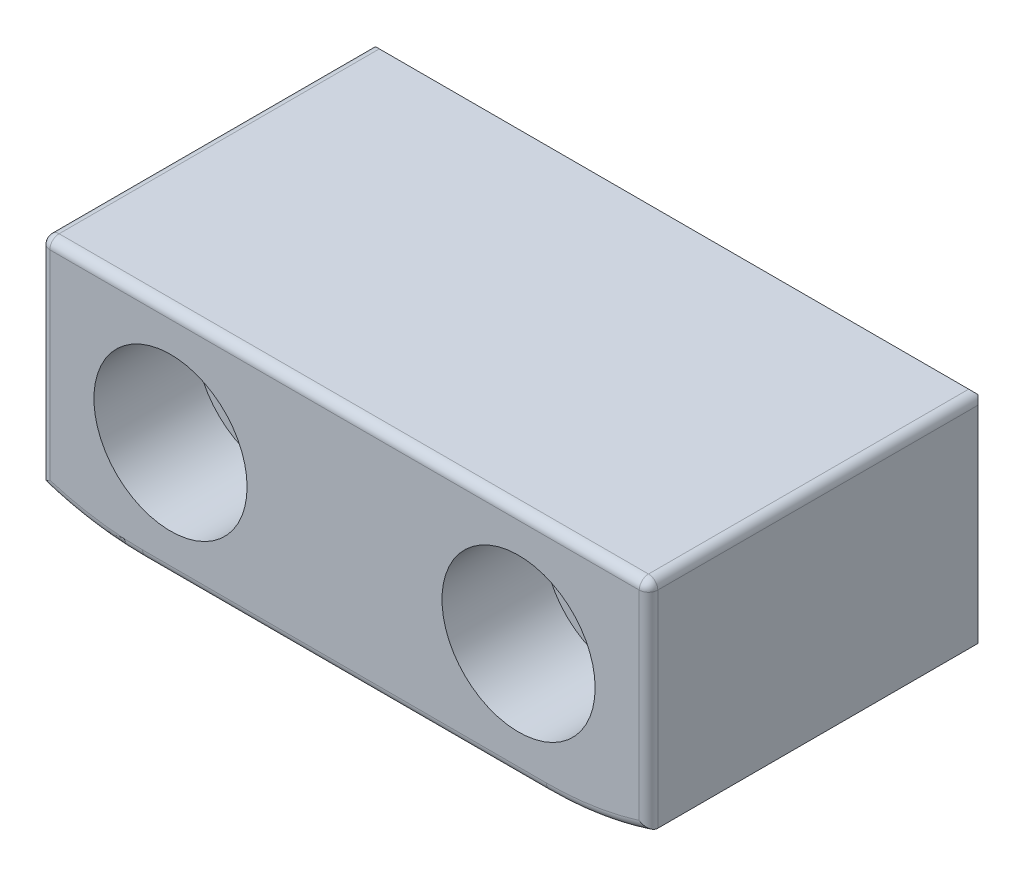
SolidWorks part; units mm, degrees
ref_plane "Front Plane" through (0, 0, 0) normal (0, 0, 1) x (1, 0, 0)
ref_plane "Top Plane" through (0, 0, 0) normal (0, 1, 0) x (1, 0, 0)
ref_plane "Right Plane" through (0, 0, 0) normal (1, 0, 0) x (0, 0, -1)
sketch "Sketch1" plane through (0, 0, 0) normal (0, 0, 1) x (1, 0, 0)
  line L0 (0, -12.7) -> (0, 0) construction
  line L1 (-11.049, -12.7) -> (11.049, -12.7)
  line L2 (-16.637, -11.7991) -> (-16.637, 0)
  line L3 (-16.637, 0) -> (16.637, 0)
  line L4 (16.637, -11.7991) -> (16.637, 0)
  line L5 (0, 0) -> (0, -12.7) construction
  arc A1 (11.049, -12.7) -> (16.637, -11.7991) centre (11.049, 5.08) ccw
  arc A2 (-11.049, -12.7) -> (-16.637, -11.7991) centre (-11.049, 5.08) cw
  dimension "D4" = 5.588
  dimension "D5" = 17.78
  dimension "D1" = 12.7
  dimension "D2" = 16.637
  dimension "D3" = 17.78
  dimension "D7" = 5.588
extrude "Boss-Extrude1" add sketch "Sketch1" against normal blind 19.05
sketch "Sketch3" plane through (0, 0, 0) normal (0, 0, 1) x (1, 0, 0)
  line L0 (-11.049, -12.7) -> (11.049, -12.7) construction
  line L1 (0, 0) -> (0, -18.1399) construction
  line L3 (16.637, 0) -> (-16.637, 0) construction
  line L4 (-16.637, 0) -> (-16.637, -11.7991) construction
  circle A0 centre (9.525, -6.35) radius 2.794
  circle A1 centre (-9.525, -6.35) radius 2.794
  dimension "D1" = 5.588
  dimension "D3" = 5.588
  dimension "D2" = 6.35
  dimension "D5" = 19.05
  dimension "D6" = 7.112
extrude "Cut-Extrude1" cut sketch "Sketch3" against normal through all
sketch "Sketch4" plane through (0, 0, 0) normal (0, 0, 1) x (1, 0, 0)
  circle A0 centre (9.525, -6.35) radius 4.191
  circle A1 centre (-9.525, -6.35) radius 4.191
  dimension "D1" = 8.382
  dimension "D2" = 8.382
extrude "Cut-Extrude2" cut sketch "Sketch4" against normal blind 5.588
chamfer "Chamfer3" distance 1.016 angle 45 6 edges at (16.637, -5.8995, -19.05) (0, -12.7, -19.05) (-13.8791, -12.4733, -19.05) (-16.637, -5.8995, -19.05) (0, 0, -19.05) (13.8791, -12.4733, -19.05)
fillet "Fillet3" radius 0.508 8 edges at (-16.637, -5.8995, 0) (-13.8791, -12.4733, 0) (0, -12.7, 0) (16.637, -5.8995, 0) (0, 0, 0) (16.637, 0, -9.017) (-16.637, 0, -9.017) (13.8791, -12.4733, 0)
